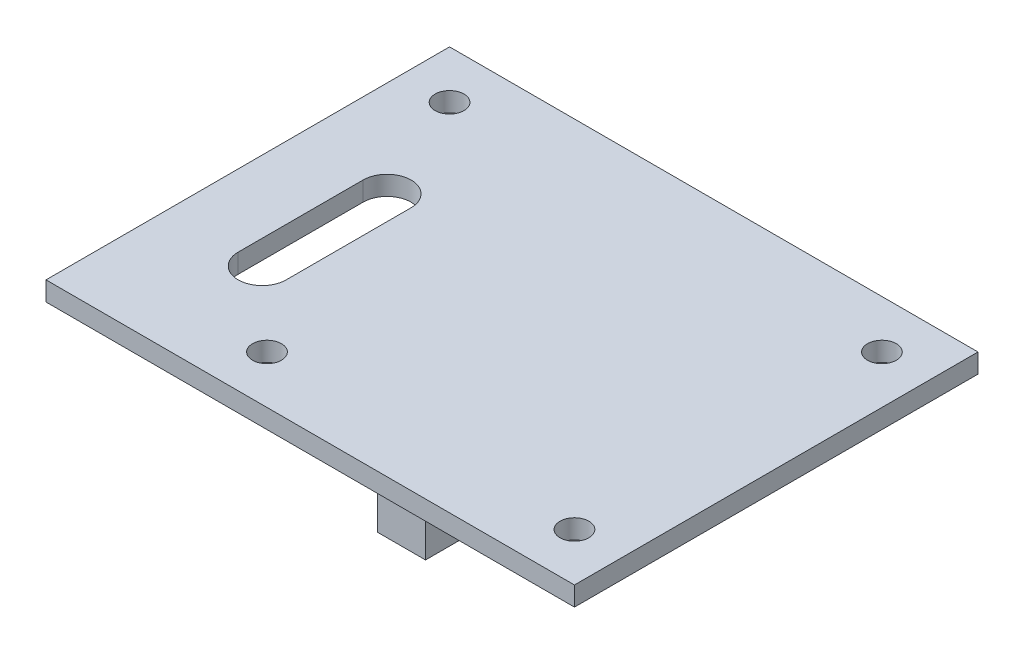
SolidWorks part; units mm, degrees
ref_plane "Přední rovina" through (0, 0, 0) normal (0, 0, 1) x (1, 0, 0)
ref_plane "Horní rovina" through (0, 0, 0) normal (0, 1, 0) x (1, 0, 0)
ref_plane "Pravá rovina" through (0, 0, 0) normal (1, 0, 0) x (0, 0, -1)
sketch "Skica1" plane through (0, 0, 0) normal (0, 1, 0) x (1, 0, 0)
  line L1 (0, 0) -> (55, 0)
  line L2 (0, 0) -> (0, 42)
  line L3 (0, 42) -> (55, 42)
  line L4 (55, 0) -> (55, 42)
  line L10 (10, 25.5) -> (10, 12.5) construction
  line L11 (12.5, 25.5) -> (12.5, 12.5)
  line L12 (7.5, 25.5) -> (7.5, 12.5)
  line L13 (65.6559, 5) -> (-3.2702, 5) construction
  line L14 (1.7525, 37) -> (64.7651, 37) construction
  arc A10 (12.5, 25.5) -> (7.5, 25.5) centre (10, 25.5) ccw
  arc A11 (7.5, 12.5) -> (12.5, 12.5) centre (10, 12.5) ccw
  circle A27 centre (5, 37) radius 1.5
  circle A28 centre (18, 5) radius 1.5
  circle A29 centre (50, 5) radius 1.5
  circle A30 centre (50, 37) radius 1.5
  point P33 (10, 19)
  dimension "D3" = 5
  dimension "D4" = 3
  dimension "D6" = 3
  dimension "D7" = 10
  dimension "D5" = 3
  dimension "D8" = 5
  dimension "D9" = 5
  dimension "D10" = 3
  dimension "D11" = 23
  dimension "D12" = 18
  dimension "D14" = 5
  dimension "D18" = 2.5
  dimension "D19" = 13
  dimension "D2" = 42
  dimension "D13" = 5
  dimension "D23" = 55
extrude "Přidat vysunutím1" add sketch "Skica1" along normal blind 2
sketch "Skica12" plane through (0, 2, 0) normal (0, 1, 0) x (1, 0, 0)
  line L0 (26, 13.5) -> (31, 13.5)
  line L2 (26, 8.5) -> (26, 13.5)
  line L3 (31, 13.5) -> (31, 8.5)
  line L5 (31, 8.5) -> (26, 8.5)
  line L7 (26, 37) -> (26, 42)
  line L8 (26, 42) -> (31, 42)
  line L9 (31, 42) -> (31, 37)
  line L10 (31, 37) -> (26, 37)
  line L11 (55, 42) -> (0, 42) construction
  arc A0 (12.5, 25.5) -> (7.5, 25.5) centre (10, 25.5) ccw construction
  arc A1 (7.5, 12.5) -> (12.5, 12.5) centre (10, 12.5) ccw construction
  point P15 (10, 28)
  point P17 (10, 10)
  dimension "D1" = 0
  dimension "D2" = 16
  dimension "D3" = 16
  dimension "D4" = 5
  dimension "D5" = 5
  dimension "D6" = 5
  dimension "D7" = 5
  dimension "D8" = 23.5
extrude "Přidat vysunutím5" add sketch "Skica12" along direction (0, -1, 0) on the side against the normal blind 12 from surface at -2
sketch "Skica13" plane through (26, 0, 0) normal (-1, 0, 0) x (0, 0, 1)
  line L0 (-13.5, -12) -> (-13.5, 0) construction
  line L1 (-37, -12) -> (-37, 0) construction
  circle A0 centre (-11, -6) radius 1
  circle A1 centre (-39.5, -6) radius 1
  dimension "D1" = 2.5
  dimension "D3" = 2
  dimension "D2" = 2.5
extrude "Odebrat vysunutím2" cut sketch "Skica13" against normal blind 6
